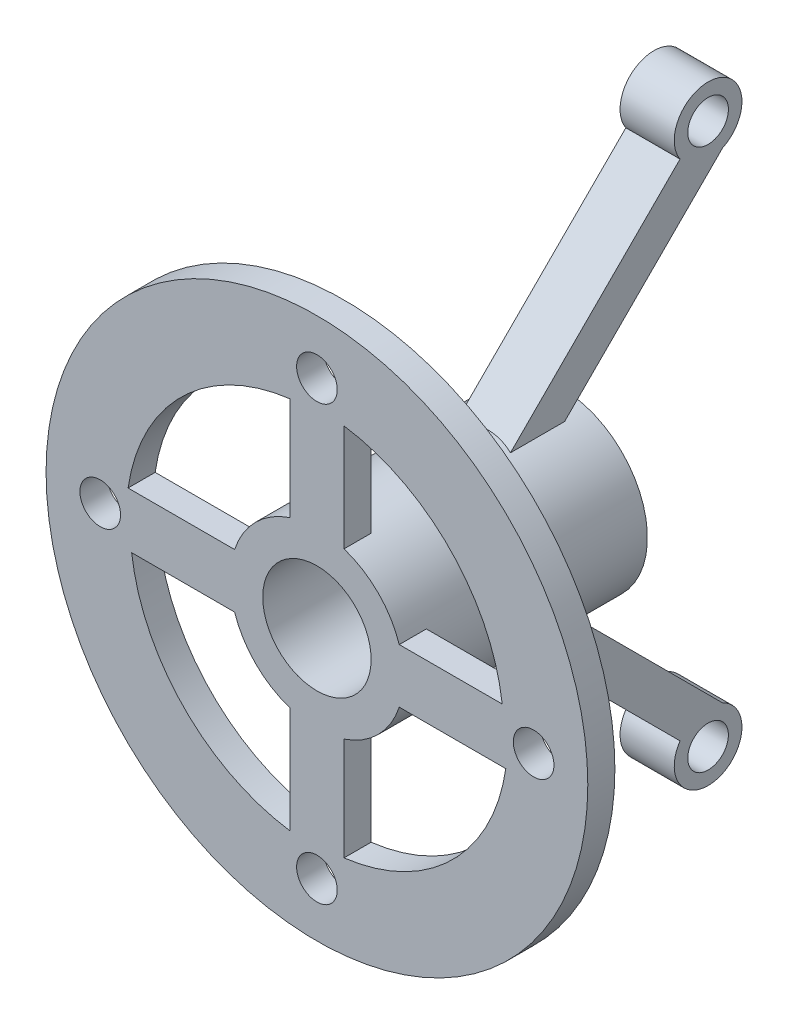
SolidWorks part; units mm, degrees
ref_plane "Front Plane" through (0, 0, 0) normal (0, 0, 1) x (1, 0, 0)
ref_plane "Top Plane" through (0, 0, 0) normal (0, 1, 0) x (1, 0, 0)
ref_plane "Right Plane" through (0, 0, 0) normal (1, 0, 0) x (0, 0, -1)
sketch "Sketch2" plane through (0, 0, 0) normal (0, 0, 1) x (1, 0, 0)
  circle A0 centre (0, 0) radius 63.5
  dimension "D1" = 127
extrude "Boss-Extrude1" add sketch "Sketch2" along normal mid plane 6.35
sketch "Sketch3" plane through (0, 0, 3.175) normal (0, 0, 1) x (1, 0, 0)
  line L0 (0, 0) -> (0, 50.8) construction
  circle A0 centre (0, 50.8) radius 4.7625
  dimension "D2" = 9.525
  dimension "D1" = 50.8
extrude "Cut-Extrude1" cut sketch "Sketch3" against normal up to next
sketch "Sketch4" plane through (0, 0, 0) normal (0, 1, 0) x (1, 0, 0)
  line L0 (0, 0) -> (0, 127) construction
  dimension "D1" = 127
pattern_circular "CirPattern1" count 4 every 90 about axis through (0, 0, 0) along (0, 0, 1) of "Cut-Extrude1"
sketch "Sketch5" plane through (0, 0, -3.175) normal (0, 0, -1) x (-1, 0, 0)
  line L0 (-19.3023, 6.35) -> (-43.4323, 6.35)
  line L1 (-6.35, 19.3023) -> (-6.35, 44.2744)
  line L2 (0, -69.3674) -> (0, 79.3964) construction
  line L3 (-66.4422, 0) -> (70.1195, 0) construction
  line L4 (6.35, 19.3023) -> (6.35, 43.4323)
  line L5 (19.3023, 6.35) -> (44.2744, 6.35)
  line L6 (19.3023, -6.35) -> (43.4323, -6.35)
  line L7 (6.35, -19.3023) -> (6.35, -44.2744)
  line L8 (-6.35, -19.3023) -> (-6.35, -43.4323)
  line L9 (-19.3023, -6.35) -> (-44.2744, -6.35)
  circle A0 centre (0, 0) radius 12.7
  arc A1 (-6.35, 19.3023) -> (-19.3023, 6.35) centre (0, 0) ccw
  arc A2 (-6.35, 44.2744) -> (-43.4323, 6.35) centre (0, 0.9737) ccw
  arc A3 (19.3023, 6.35) -> (6.35, 19.3023) centre (0, 0) ccw
  arc A4 (44.2744, 6.35) -> (6.35, 43.4323) centre (0.9737, 0) ccw
  arc A5 (6.35, -19.3023) -> (19.3023, -6.35) centre (0, 0) ccw
  arc A6 (6.35, -44.2744) -> (43.4323, -6.35) centre (0, -0.9737) ccw
  arc A7 (-19.3023, -6.35) -> (-6.35, -19.3023) centre (0, 0) ccw
  arc A8 (-44.2744, -6.35) -> (-6.35, -43.4323) centre (-0.9737, 0) ccw
  point P12 (-14.3684, 14.3684)
  point P13 (-31.2911, 31.57)
  point P32 (0, 0)
  dimension "D1" = 25.4
  dimension "D4" = 44.45
  dimension "D6" = 24.13
  dimension "D2" = 6.35
  dimension "D3" = 20.32
  dimension "D5" = 6.35
  dimension "D7" = 4
extrude "Cut-Extrude2" cut sketch "Sketch5" against normal up to next
sketch "Sketch6" plane through (0, 0, -3.175) normal (0, 0, -1) x (-1, 0, 0)
  circle A0 centre (0, 0) radius 12.7
  circle A1 centre (0, 0) radius 20.32
  circle A2 centre (0, 0) radius 12.7 construction
  arc A3 (-19.3023, -6.35) -> (-6.35, -19.3023) centre (0, 0) ccw construction
extrude "Boss-Extrude2" add sketch "Sketch6" along normal blind 50.8
ref_plane "Plane1" through (0, 15.2107, 0) normal (0, 1, 0) x (1, 0, 0)
sketch "Sketch7" plane through (0, 0, 0) normal (1, 0, 0) x (0, 0, -1)
  line L0 (31.75, 15.2107) -> (44.45, 15.2107)
  line L1 (69.85, 15.2107) -> (-69.85, 15.2107) construction
  line L2 (44.45, 15.2107) -> (89.3513, 60.112)
  line L3 (89.3513, 60.112) -> (76.6513, 60.112)
  line L4 (76.6513, 60.112) -> (31.75, 15.2107)
  line L5 (0, 0) -> (127, 0) construction
  line L6 (0, 0) -> (61.5319, 0) construction
  line L7 (89.3513, -60.112) -> (76.6513, -60.112)
  line L8 (31.75, -15.2107) -> (44.45, -15.2107)
  line L9 (44.45, -15.2107) -> (89.3513, -60.112)
  line L10 (76.6513, -60.112) -> (31.75, -15.2107)
  dimension "D1" = 45
  dimension "D2" = 63.5
  dimension "D3" = 12.7
  dimension "D4" = 31.75
extrude "Boss-Extrude3" add sketch "Sketch7" along normal mid plane 12.7
sketch "Sketch8" plane through (0, 0, 0) normal (1, 0, 0) x (0, 0, -1)
  line L0 (82.1732, 0) -> (82.1732, 63.5) construction
  line L1 (0, 0) -> (127, 0) construction
  line L2 (0, 0) -> (82.1732, 0) construction
  circle A0 centre (82.1732, 63.5) radius 7.9375
  circle A1 centre (82.1732, -63.5) radius 7.9375
  dimension "D1" = 15.875
  dimension "D2" = 63.5
extrude "Boss-Extrude4" add sketch "Sketch8" along normal mid plane 12.7
sketch "Sketch9" plane through (6.35, 0, 0) normal (1, 0, 0) x (0, 0, -1)
  line L0 (0, 0) -> (82.8002, 0) construction
  circle A0 centre (82.1732, 63.5) radius 4.7625
  arc A1 (85.5612, 56.3219) -> (75.5959, 59.0566) centre (82.1732, 63.5) ccw construction
  circle A2 centre (82.1732, -63.5) radius 4.7625
  dimension "D1" = 9.525
extrude "Cut-Extrude3" cut sketch "Sketch9" against normal up to next
sketch "Sketch10" plane through (0, 0, 0) normal (1, 0, 0) x (0, 0, -1)
  point P0 (82.1732, 63.5)
  point P1 (82.1732, -63.5)
